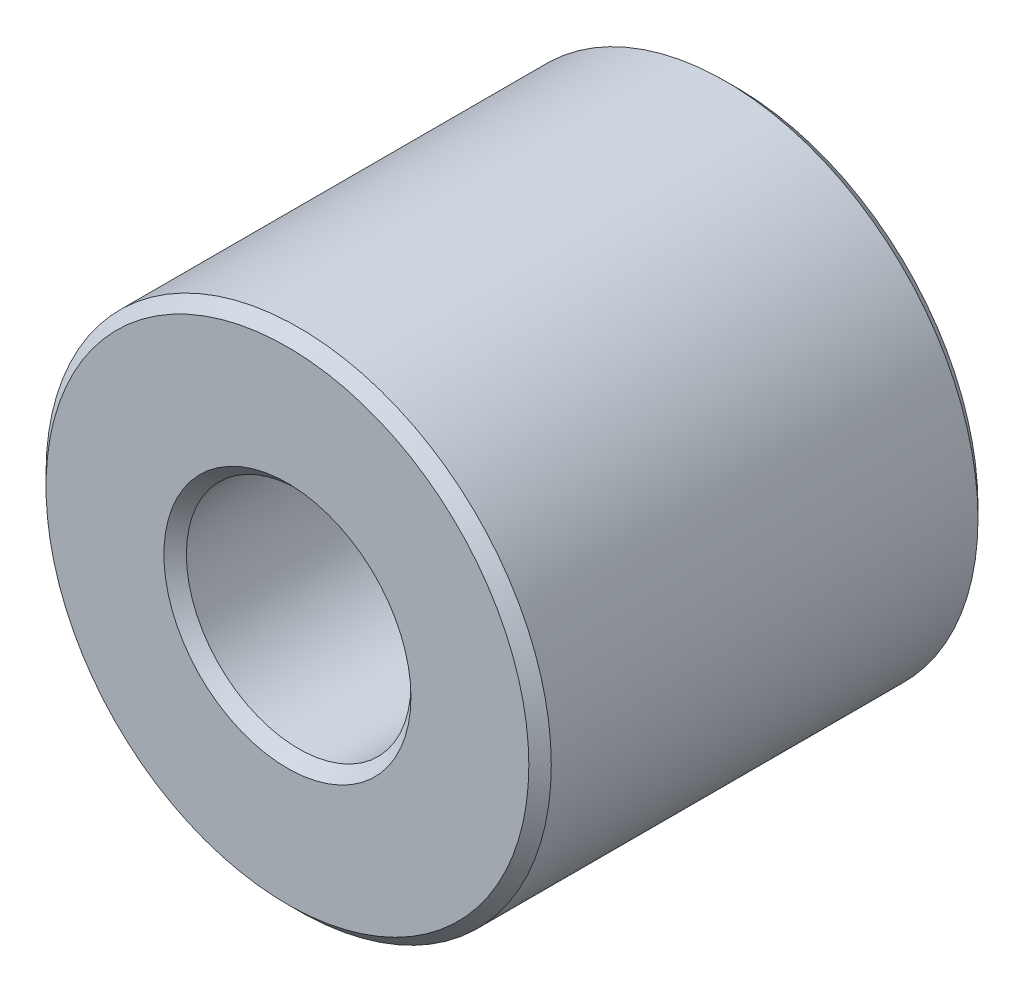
SolidWorks part; units mm, degrees
ref_plane "Front Plane" through (0, 0, 0) normal (0, 0, 1) x (1, 0, 0)
ref_plane "Top Plane" through (0, 0, 0) normal (0, 1, 0) x (1, 0, 0)
ref_plane "Right Plane" through (0, 0, 0) normal (1, 0, 0) x (0, 0, -1)
sketch "Sketch1" plane through (0, 0, 0) normal (0, 0, 1) x (1, 0, 0)
  circle A0 centre (0, 0) radius 4
  circle A1 centre (0, 0) radius 9
  dimension "D1" = 8
  dimension "D2" = 18
extrude "Boss-Extrude1" add sketch "Sketch1" along normal mid plane 16
chamfer "Chamfer1" distance 0.4 angle 45 4 edges at (4, 0, -8) (9, 0, -8) (4, 0, 8) (9, 0, 8)
